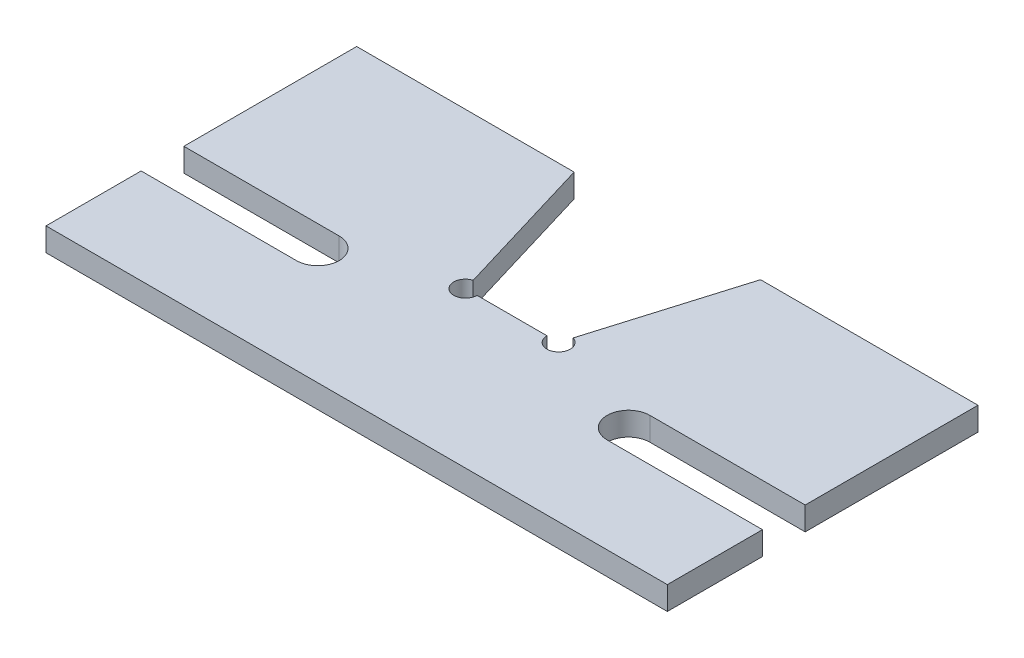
SolidWorks part; units mm, degrees
ref_plane "Front Plane" through (0, 0, 0) normal (0, 0, 1) x (1, 0, 0)
ref_plane "Top Plane" through (0, 0, 0) normal (0, 1, 0) x (1, 0, 0)
ref_plane "Right Plane" through (0, 0, 0) normal (1, 0, 0) x (0, 0, -1)
sketch "Sketch1" plane through (0, 0, 0) normal (0, 1, 0) x (1, 0, 0)
  line L0 (20, 17.75) -> (0, 17.75)
  line L1 (0, 0) -> (80, 0)
  line L2 (0, 0) -> (0, 12.25)
  line L3 (0, 40) -> (28, 40)
  line L4 (80, 0) -> (80, 12.25)
  line L5 (20, 12.25) -> (0, 12.25)
  line L6 (60, 17.75) -> (80, 17.75)
  line L7 (60, 12.25) -> (80, 12.25)
  line L8 (46.431, 21.4367) -> (52, 40)
  line L9 (33.569, 21.4367) -> (28, 40)
  line L10 (44.5, 20) -> (35.5, 20)
  line L11 (52, 40) -> (80, 40)
  line L12 (0, 17.75) -> (0, 40)
  line L13 (80, 17.75) -> (80, 40)
  line L14 (40, 20) -> (40, 0) construction
  line L15 (60, 15) -> (20, 15) construction
  arc A0 (20, 12.25) -> (20, 17.75) centre (20, 15) ccw
  arc A1 (60, 17.75) -> (60, 12.25) centre (60, 15) ccw
  arc A2 (33.569, 21.4367) -> (35.5, 20) centre (34, 20) ccw
  arc A3 (44.5, 20) -> (46.431, 21.4367) centre (46, 20) ccw
  dimension "D1" = 3
  dimension "D2" = 5.5
  dimension "D8" = 20
  dimension "D3" = 28
  dimension "D4" = 12
  dimension "D5" = 12
  dimension "D6" = 28
  dimension "D7" = 15
  dimension "D9" = 20
  dimension "D10" = 20
  dimension "D11" = 40
  dimension "D12" = 6
extrude "Extrude1" add sketch "Sketch1" along normal blind 3
